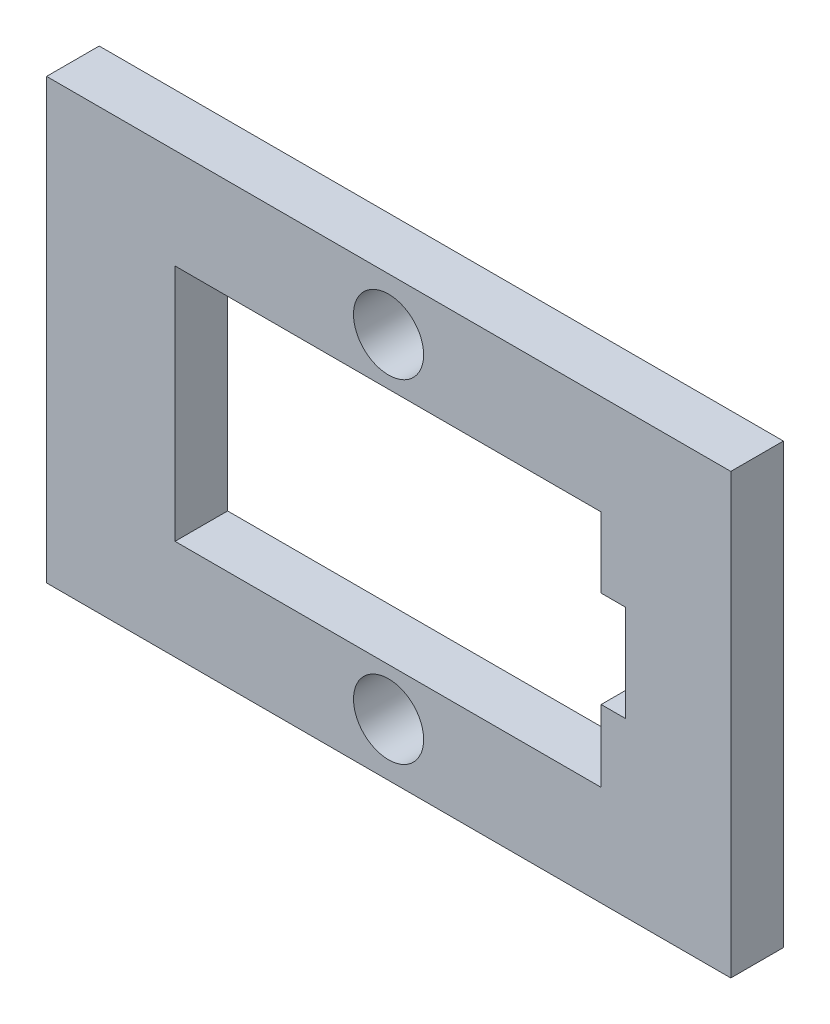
SolidWorks part; units mm, degrees
ref_plane "Front Plane" through (0, 0, 0) normal (0, 0, 1) x (1, 0, 0)
ref_plane "Top Plane" through (0, 0, 0) normal (0, 1, 0) x (1, 0, 0)
ref_plane "Right Plane" through (0, 0, 0) normal (1, 0, 0) x (0, 0, -1)
imported_body "Imported1"
sketch "Sketch3" plane through (0, 0, 3) normal (0, 0, 1) x (1, 0, 0)
  line L1 (-7.9733, 18.4) -> (31.0425, 18.4)
  line L2 (-7.9733, 18.4) -> (-7.9733, -6.6187)
  line L3 (-7.9733, -6.6187) -> (31.0425, -6.6187)
  line L4 (31.0425, 18.4) -> (31.0425, -6.6187)
extrude "Extrude1" add sketch "Sketch3" against normal blind 3
sketch "Sketch2" plane through (0, 0, 0) normal (0, 0, 1) x (1, 0, 0)
  line L0 (23.65, 8.6907) -> (23.65, 12.7)
  line L1 (-0.65, 12.7) -> (23.65, 12.7)
  line L2 (-0.65, 12.7) -> (-0.65, -0.9)
  line L3 (-0.65, -0.9) -> (23.65, -0.9)
  line L4 (23.65, 3.1925) -> (23.65, -0.9)
  line L5 (25.0511, 8.6907) -> (23.65, 8.6907)
  line L6 (25.0511, 8.6907) -> (25.0511, 3.1925)
  line L7 (25.0511, 3.1925) -> (23.65, 3.1925)
  circle A0 centre (11.5267, 15.4) radius 2
  circle A1 centre (11.5267, -3.6) radius 2
extrude "Cut-Extrude1" cut sketch "Sketch2" along normal blind 3
